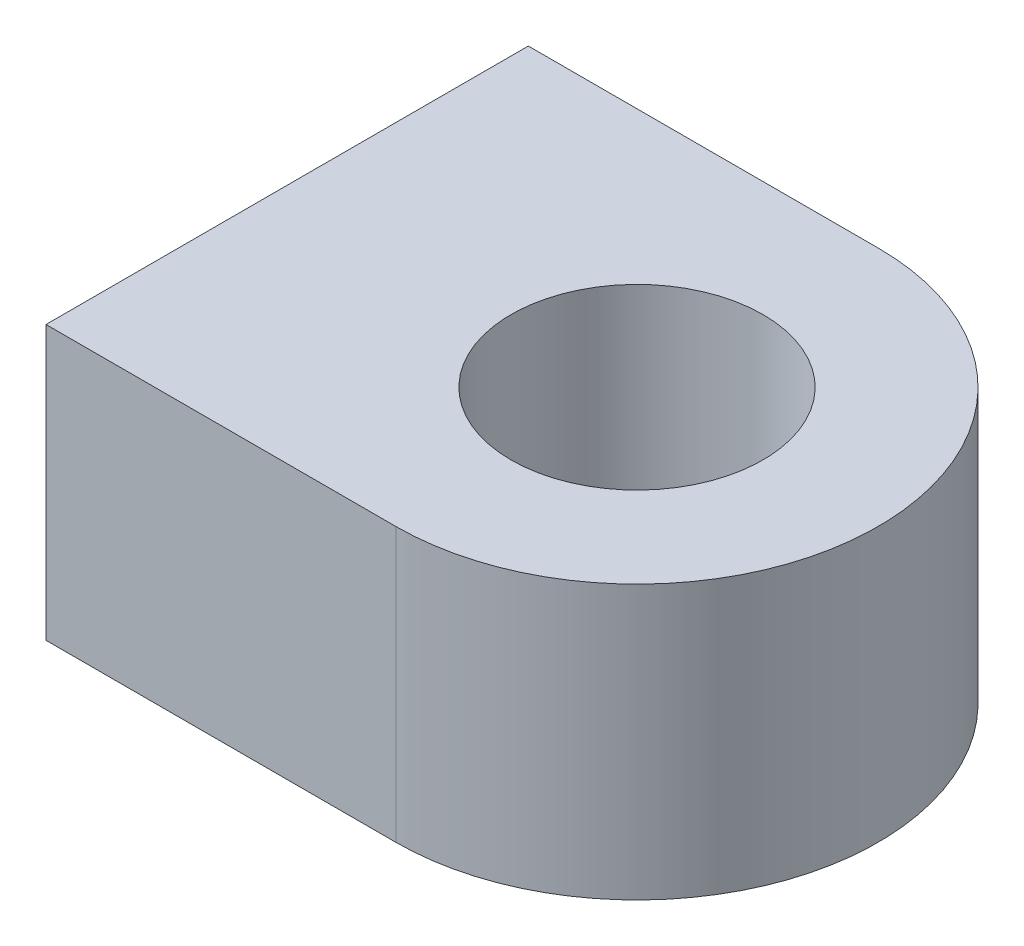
SolidWorks part; units mm, degrees
ref_plane "Front Plane" through (0, 0, 0) normal (0, 0, 1) x (1, 0, 0)
ref_plane "Top Plane" through (0, 0, 0) normal (0, 1, 0) x (1, 0, 0)
ref_plane "Right Plane" through (0, 0, 0) normal (1, 0, 0) x (0, 0, -1)
sketch "Sketch1" plane through (0, 0, 0) normal (0, 1, 0) x (1, 0, 0)
  circle A0 centre (0, 0) radius 2.2225
  circle A1 centre (0, 0) radius 4.1275
  dimension "D1" = 4.445
  dimension "D2" = 1.905
extrude "Boss-Extrude1" add sketch "Sketch1" along normal blind 5.08 contours A1 A0
sketch "Sketch2" plane through (0, 0, 0) normal (0, -1, 0) x (1, 0, 0)
  circle A1 centre (0, 0) radius 4.1275
  circle A2 centre (0, 0) radius 4.1275
  dimension "D1" = 0
extrude "Boss-Extrude2" add sketch "Sketch2" against normal blind 0.762
sketch "Sketch3" plane through (0, 5.08, 0) normal (0, 1, 0) x (1, 0, 0)
  line L1 (-6.1722, -4.2545) -> (-6.1722, 4.2545)
  line L2 (0, -4.1275) -> (-6.1722, -4.1275)
  line L3 (0, 4.1275) -> (-6.1722, 4.1275)
  circle A1 centre (0, 0) radius 4.1275
  circle A2 centre (0, 0) radius 4.1275
  dimension "D1" = 0
extrude "Boss-Extrude3" add sketch "Sketch3" against normal up to surface (5.08 mm away) contours L3 L1 L2 M3
sketch "Sketch4" plane through (0, 5.08, 0) normal (0, 1, 0) x (1, 0, 0)
  line L3 (0, 4.1275) -> (-6.1722, 4.1275)
  line L4 (-6.1722, 4.1275) -> (-6.1722, -4.1275)
  line L5 (-6.1722, -4.1275) -> (0, -4.1275)
  line L6 (0, 4.1275) -> (-6.1722, 4.1275)
  line L7 (-6.1722, 4.1275) -> (-6.1722, -4.1275)
  line L8 (-6.1722, -4.1275) -> (0, -4.1275)
  line L22 (6.1722, 25.2998) -> (-48.0166, 25.2998)
  line L23 (-48.0166, 25.2998) -> (-48.0166, -0.3542)
  line L24 (-45.4766, -2.8942) -> (-22.0218, -2.8942)
  line L25 (-22.0218, -2.8942) -> (-22.0218, -36.3262)
  line L26 (-19.4818, -38.8662) -> (6.1722, -38.8662)
  line L27 (6.1722, -38.8662) -> (6.1722, 25.2998)
  line L28 (0, -30.1653) -> (-6.1722, -30.1653)
  line L29 (-6.1722, -30.1653) -> (-6.1722, -38.8662)
  line L30 (-6.1722, -38.8662) -> (6.1722, -38.8662)
  line L31 (6.1722, -38.8662) -> (6.1722, 12.9554)
  line L32 (6.1722, 12.9554) -> (-6.1722, 12.9554)
  line L33 (-6.1722, 12.9554) -> (-6.1722, 4.2545)
  line L34 (-6.1722, 4.2545) -> (0, 4.2545)
  line L35 (0, -4.2545) -> (-6.1722, -4.2545)
  line L36 (-6.1722, -4.2545) -> (-6.1722, -21.6563)
  line L37 (-6.1722, -21.6563) -> (0, -21.6563)
  line L38 (-6.1722, -4.2545) -> (-6.1722, -4.1275)
  line L39 (-6.1722, 4.1275) -> (-6.1722, 4.2545)
  arc A1 (0, -4.1275) -> (0, 4.1275) centre (0, 0) ccw
  arc A2 (0, -4.1275) -> (0, 4.1275) centre (0, 0) ccw
  arc A6 (-48.0166, -0.3542) -> (-45.4766, -2.8942) centre (-45.4766, -0.3542) ccw
  arc A7 (-22.0218, -36.3262) -> (-19.4818, -38.8662) centre (-19.4818, -36.3262) ccw
  arc A8 (0, -30.1653) -> (0, -21.6563) centre (0, -25.9108) ccw
  arc A9 (0, -4.2545) -> (0, 4.2545) centre (0, 0) ccw
  dimension "D1" = 0
extrude "Boss-Extrude5" add sketch "Sketch4" against normal up to surface (5.08 mm away) contours L35 A9 L34 L39 L38 M7 M6 M9
sketch "Sketch5" plane through (0, 5.08, 0) normal (0, 1, 0) x (1, 0, 0)
  line L3 (-6.1722, 4.2545) -> (-6.1722, -4.2545)
  line L4 (-6.1722, -4.2545) -> (0, -4.2545)
  line L5 (0, 4.2545) -> (-6.1722, 4.2545)
  line L6 (-6.1722, 4.2545) -> (-6.1722, -4.2545)
  line L7 (-6.1722, -4.2545) -> (0, -4.2545)
  line L8 (0, 4.2545) -> (-6.1722, 4.2545)
  arc A1 (0, -4.2545) -> (0, 4.2545) centre (0, 0) ccw
  arc A2 (0, -4.2545) -> (0, 4.2545) centre (0, 0) ccw
  dimension "D1" = 0
extrude "Cut-Extrude1" cut sketch "Sketch5" against normal blind 0.254
